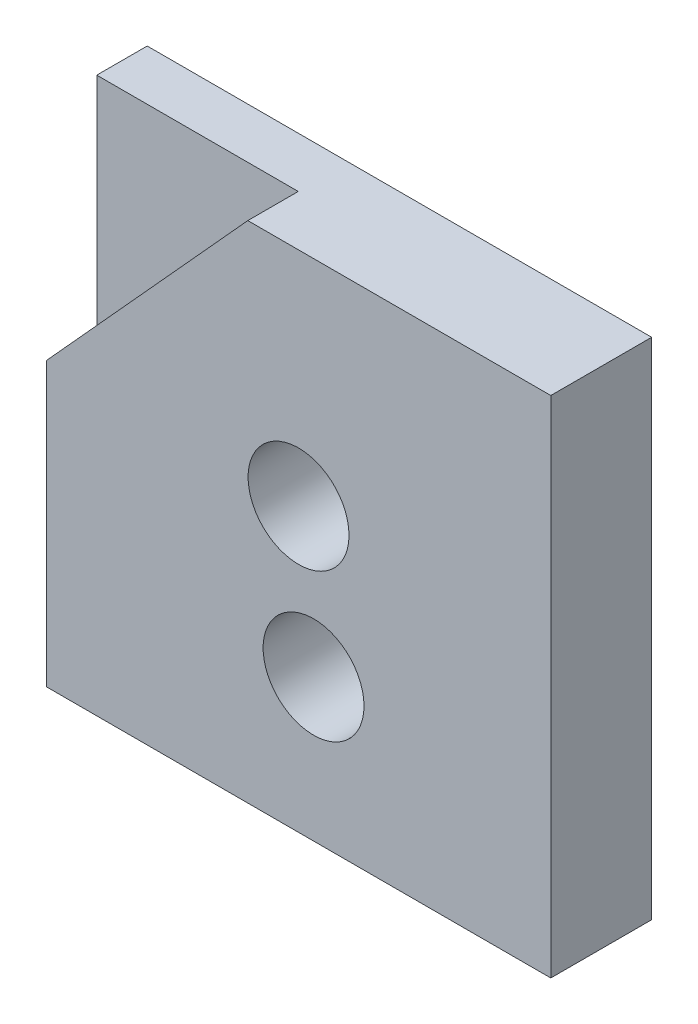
SolidWorks part; units mm, degrees
ref_plane "Plan de face" through (0, 0, 0) normal (0, 0, 1) x (1, 0, 0)
ref_plane "Plan de dessus" through (0, 0, 0) normal (0, 1, 0) x (1, 0, 0)
ref_plane "Plan de droite" through (0, 0, 0) normal (1, 0, 0) x (0, 0, -1)
sketch "Esquisse1" plane through (0, 0, 0) normal (0, 0, 1) x (1, 0, 0)
  line L0 (-50, 0) -> (-23.5116, 14.0841) construction
  line L1 (0, 0) -> (-50, 0)
  line L2 (0, 0) -> (0, 50)
  line L3 (0, 50) -> (-50, 50)
  line L4 (-50, 0) -> (-50, 50)
  circle A0 centre (-23.5116, 14.0841) radius 5
  dimension "D3" = 10
  dimension "D1" = 50
  dimension "D2" = 50
  dimension "D4" = 28
  dimension "D5" = 30
extrude "Boss.-Extru.1" add sketch "Esquisse1" along normal blind 10
sketch "Esquisse2" plane through (0, 0, 10) normal (0, 0, 1) x (1, 0, 0)
  line L0 (-50, 28) -> (-30.03, 50)
  line L1 (-50, 50) -> (-50, 0) construction
  line L2 (0, 50) -> (-50, 50) construction
  line L3 (-30.03, 50) -> (-50, 50)
  line L4 (-50, 50) -> (-50, 28)
  dimension "D1" = 28
  dimension "D2" = 19.97
extrude "Enlèv. mat.-Extru.1" cut sketch "Esquisse2" against normal blind 5
sketch "Esquisse3" plane through (0, 0, 10) normal (0, 0, 1) x (1, 0, 0)
  line L0 (-50, 50) -> (-50, 0) construction
  line L1 (-50, 0) -> (0, 0) construction
  circle A0 centre (-25, 28) radius 5
  point P2 (-50, 25)
  dimension "D3" = 10
  dimension "D1" = 25
  dimension "D2" = 28
extrude "Enlèv. mat.-Extru.2" cut sketch "Esquisse3" against normal through all
